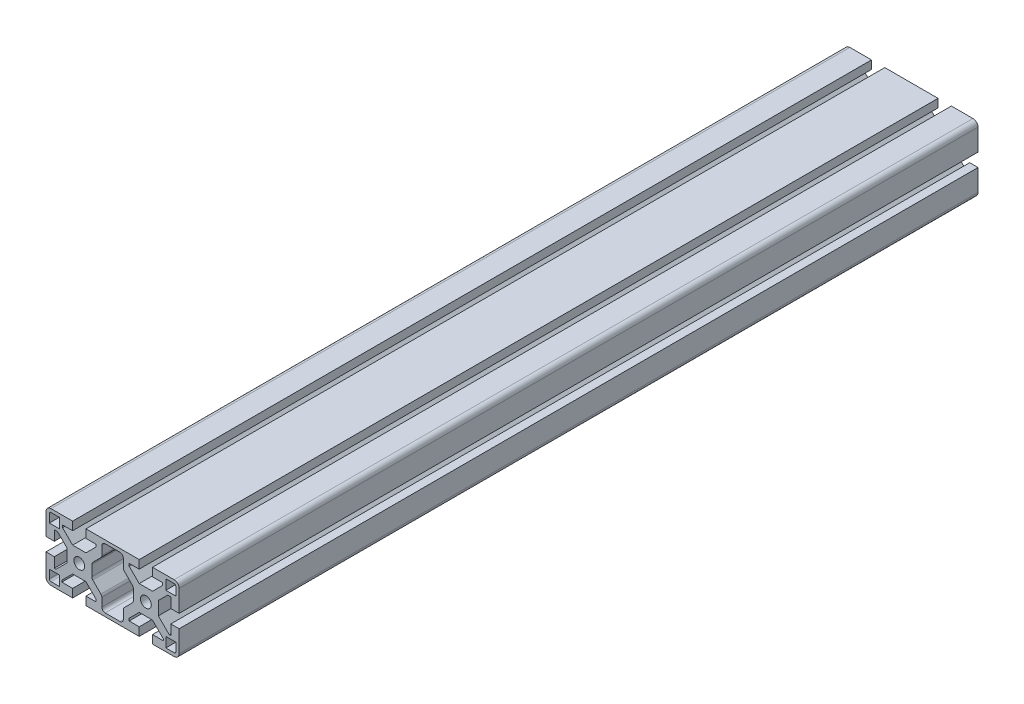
SolidWorks part; units mm, degrees
ref_plane "Alzado" through (0, 0, 0) normal (0, 0, 1) x (1, 0, 0)
ref_plane "Planta" through (0, 0, 0) normal (0, 1, 0) x (1, 0, 0)
ref_plane "Vista lateral" through (0, 0, 0) normal (1, 0, 0) x (0, 0, -1)
sketch "Croquis1" plane through (0, 0, 0) normal (0, 0, 1) x (1, 0, 0)
  line L0 (-18, 12) -> (-12, 12)
  line L1 (-12, 12) -> (-12, 18)
  line L2 (-17, 18) -> (-12, 18)
  line L3 (-18, 12) -> (-18, 17)
  line L4 (24.45, 18) -> (15.55, 18)
  line L5 (31.9142, 4.5858) -> (27.0358, 9.4642)
  line L6 (31.9142, -4.5858) -> (27.0358, -9.4642)
  line L7 (50.0629, 13.55) -> (50.0629, 15)
  line L8 (-17, -18) -> (-12, -18)
  line L9 (-12, -18) -> (-12, -12)
  line L10 (-18, -12) -> (-12, -12)
  line L11 (-18, -17) -> (-18, -12)
  line L12 (50.0629, 13.55) -> (44, 7.5)
  line L13 (50.0629, 15) -> (44, 15)
  line L14 (29.95, 13.55) -> (29.95, 15)
  line L15 (36, 7.5) -> (29.95, 13.55)
  line L16 (-4, 7.5) -> (4, 7.5)
  line L17 (-17, 20) -> (-4, 20)
  line L18 (-7.5, -3.55) -> (-7.5, 4.45)
  line L19 (-4, -7.5) -> (4, -7.5)
  line L20 (7.5, -3.1716) -> (7.5, 3.1716)
  line L21 (36, 15) -> (29.95, 15)
  line L22 (4, 20) -> (4, 15)
  line L23 (55, 10.05) -> (53.1, 10.05)
  line L24 (4, 20) -> (36, 20)
  line L25 (-17, -20) -> (-4, -20)
  line L26 (-4, -20) -> (-4, -15)
  line L27 (36, -20) -> (4, -20)
  line L28 (-15, -10.05) -> (-15, -4)
  line L29 (-20, 4) -> (-20, 17)
  line L30 (-20, -17) -> (-20, -4)
  line L31 (-20, -4) -> (-15, -4)
  line L32 (4, -20) -> (4, -15)
  line L33 (-4, 20) -> (-4, 15)
  line L34 (47.5, 4.45) -> (53.1, 10.05)
  line L35 (55, 4) -> (55, 10.05)
  line L36 (60, 4) -> (55, 4)
  line L37 (4, -15) -> (10.05, -15)
  line L38 (-10.5, -15) -> (-4, -15)
  line L39 (-10.5, -14) -> (-4, -7.5)
  line L40 (-10.5, -14) -> (-10.5, -15)
  line L41 (4, -7.5) -> (10.05, -13.55)
  line L42 (10.05, -15) -> (10.05, -13.55)
  line L43 (-7.5, -3.55) -> (-14, -10.05)
  line L44 (-15, -10.05) -> (-14, -10.05)
  line L45 (-20, 4) -> (-15, 4)
  line L46 (-15, 4) -> (-15, 10.05)
  line L47 (-7.5, 4.45) -> (-13.1, 10.05)
  line L48 (-15, 10.05) -> (-13.1, 10.05)
  line L49 (4, 15) -> (10.05, 15)
  line L50 (4, 7.5) -> (10.05, 13.55)
  line L51 (10.05, 13.55) -> (10.05, 15)
  line L52 (-10.0629, 15) -> (-4, 15)
  line L53 (-10.0629, 13.55) -> (-4, 7.5)
  line L54 (-10.0629, 13.55) -> (-10.0629, 15)
  line L55 (55, -10.05) -> (54, -10.05)
  line L56 (47.5, -3.55) -> (54, -10.05)
  line L57 (8.0858, -4.5858) -> (12.9642, -9.4642)
  line L58 (29.95, -15) -> (29.95, -13.55)
  line L59 (8.0858, 4.5858) -> (12.9642, 9.4642)
  line L60 (36, -7.5) -> (29.95, -13.55)
  line L61 (50.5, -14) -> (50.5, -15)
  line L62 (50.5, -14) -> (44, -7.5)
  line L63 (50.5, -15) -> (44, -15)
  line L64 (36, -15) -> (29.95, -15)
  line L65 (44, 20) -> (44, 15)
  line L66 (36, -20) -> (36, -15)
  line L67 (60, -4) -> (55, -4)
  line L68 (60, -17) -> (60, -4)
  line L69 (60, 4) -> (60, 17)
  line L70 (55, -10.05) -> (55, -4)
  line L71 (44, -20) -> (44, -15)
  line L72 (57, -20) -> (44, -20)
  line L73 (36, 20) -> (36, 15)
  line L74 (32.5, -3.1716) -> (32.5, 3.1716)
  line L75 (44, -7.5) -> (36, -7.5)
  line L76 (47.5, -3.55) -> (47.5, 4.45)
  line L77 (57, 20) -> (44, 20)
  line L78 (44, 7.5) -> (36, 7.5)
  line L79 (58, -17) -> (58, -12)
  line L80 (58, -12) -> (52, -12)
  line L81 (52, -18) -> (52, -12)
  line L82 (57, -18) -> (52, -18)
  line L83 (58, 12) -> (58, 17)
  line L84 (57, 18) -> (52, 18)
  line L85 (52, 12) -> (52, 18)
  line L86 (58, 12) -> (52, 12)
  line L87 (13.55, 10.8784) -> (13.55, 16)
  line L88 (26.45, 10.8784) -> (26.45, 16)
  line L89 (24.45, -18) -> (15.55, -18)
  line L90 (13.55, -10.8784) -> (13.55, -16)
  line L91 (26.45, -10.8784) -> (26.45, -16)
  arc A0 (-18, 17) -> (-17, 18) centre (-17, 17) cw
  arc A1 (57, -20) -> (60, -17) centre (57, -17) ccw
  arc A2 (-18, -17) -> (-17, -18) centre (-17, -17) ccw
  arc A3 (60, 17) -> (57, 20) centre (57, 17) ccw
  circle A4 centre (0, 0) radius 3.25
  circle A5 centre (40, 0) radius 3.25
  arc A6 (-20, 17) -> (-17, 20) centre (-17, 17) cw
  arc A7 (-17, -20) -> (-20, -17) centre (-17, -17) cw
  arc A8 (58, -17) -> (57, -18) centre (57, -17) cw
  arc A9 (58, 17) -> (57, 18) centre (57, 17) ccw
  arc A10 (13.55, 16) -> (15.55, 18) centre (15.55, 16) cw
  arc A11 (12.9642, 9.4642) -> (13.55, 10.8784) centre (11.55, 10.8784) ccw
  arc A12 (7.5, 3.1716) -> (8.0858, 4.5858) centre (9.5, 3.1716) cw
  arc A13 (8.0858, -4.5858) -> (7.5, -3.1716) centre (9.5, -3.1716) cw
  arc A14 (13.55, -10.8784) -> (12.9642, -9.4642) centre (11.55, -10.8784) ccw
  arc A15 (15.55, -18) -> (13.55, -16) centre (15.55, -16) cw
  arc A16 (26.45, -16) -> (24.45, -18) centre (24.45, -16) cw
  arc A17 (32.5, -3.1716) -> (31.9142, -4.5858) centre (30.5, -3.1716) cw
  arc A18 (26.45, -10.8784) -> (27.0358, -9.4642) centre (28.45, -10.8784) cw
  arc A19 (26.45, 16) -> (24.45, 18) centre (24.45, 16) ccw
  arc A20 (26.45, 10.8784) -> (27.0358, 9.4642) centre (28.45, 10.8784) ccw
  arc A21 (32.5, 3.1716) -> (31.9142, 4.5858) centre (30.5, 3.1716) ccw
  point P115 (13.55, 10.05)
  point P118 (7.5, 4)
  point P121 (7.5, -4)
  point P124 (13.55, -10.05)
extrude "Extruir5" add sketch "Croquis1" along normal blind 480
